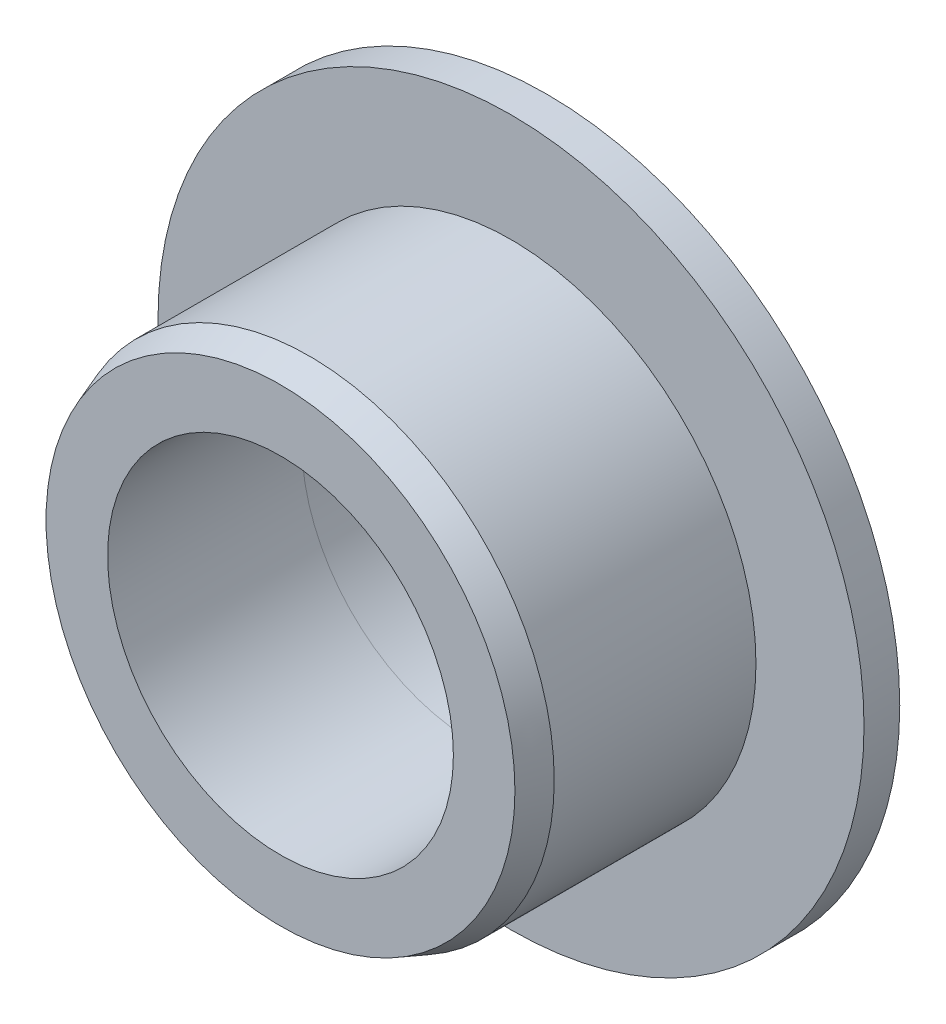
SolidWorks part; units mm, degrees
ref_plane "Plan1" through (0, 0, 0) normal (0, 0, 1) x (1, 0, 0)
ref_plane "Plan2" through (0, 0, 0) normal (0, 1, 0) x (1, 0, 0)
ref_plane "Plan3" through (0, 0, 0) normal (1, 0, 0) x (0, 0, -1)
sketch "Esquisse1" plane through (0, 0, 0) normal (0, 0, 1) x (1, 0, 0)
  circle A0 centre (0, 0) radius 24.5
  dimension "D1" = 49
extrude "Base-Extrusion" add sketch "Esquisse1" along normal blind 2.48
sketch "Esquisse2" plane through (0, 0, 2.48) normal (0, 0, 1) x (1, 0, 0)
  circle A0 centre (0, 0) radius 17
  dimension "D1" = 34
extrude "Boss.-Extru.1" add sketch "Esquisse2" along normal blind 16
chamfer "Chanfrein1" distance 2 angle 20
sketch "Esquisse3" plane through (0, 0, 18.48) normal (0, 0, 1) x (1, 0, 0)
  circle A0 centre (0, 0) radius 12
  dimension "D1" = 24
extrude "Enlèv. mat.-Extru.1" cut sketch "Esquisse3" against normal through all
chamfer "Chanfrein2" distance 0.5 angle 45
sketch "Esquisse4" plane through (0, 0, 0) normal (0, 0, -1) x (-1, 0, 0)
  circle A0 centre (0, 0) radius 12.05
  dimension "D1" = 24.1
extrude "Enlèv. mat.-Extru.2" cut sketch "Esquisse4" against normal blind 5
